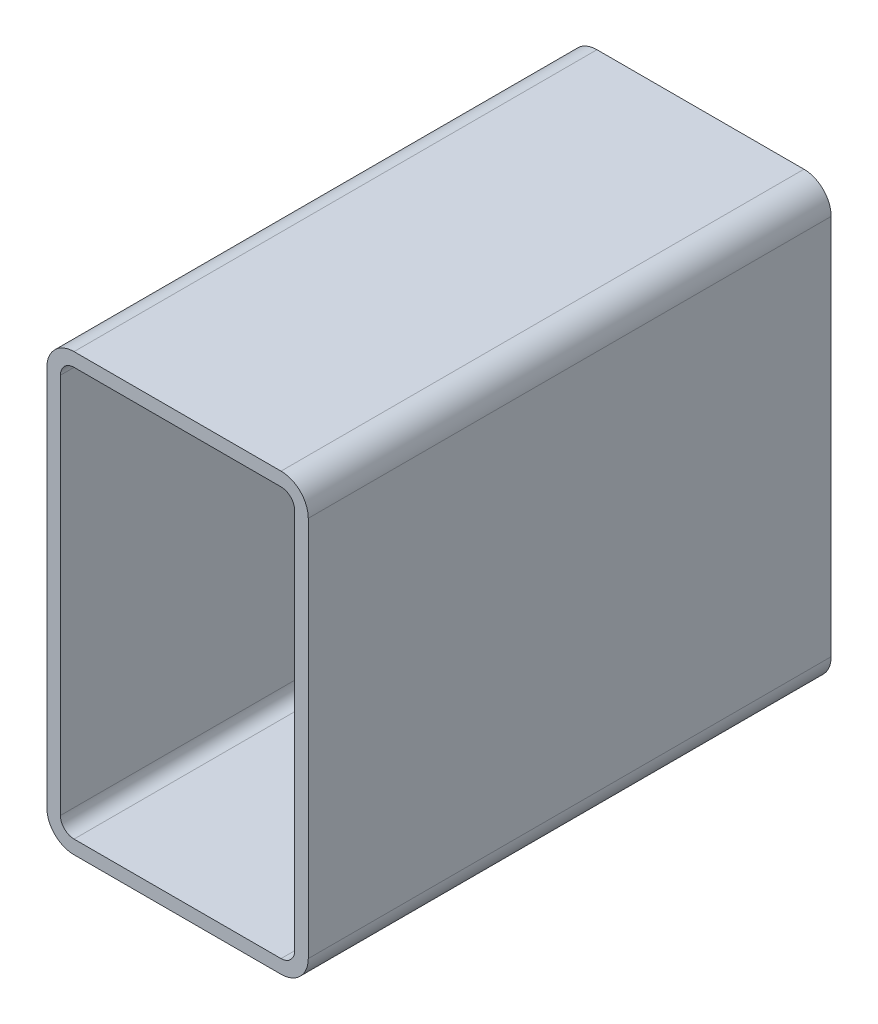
SolidWorks part; units mm, degrees
ref_plane "Front Plane" through (0, 0, 0) normal (0, 0, 1) x (1, 0, 0)
ref_plane "Top Plane" through (0, 0, 0) normal (0, 1, 0) x (1, 0, 0)
ref_plane "Right Plane" through (0, 0, 0) normal (1, 0, 0) x (0, 0, -1)
sketch "Sketch1" plane through (0, 0, 0) normal (0, 0, 1) x (1, 0, 0)
sketch_block_instance "HSS10x6x0.3125-1"
sketch_block "HSS10x6x0.3125"
extrude "Boss-Extrude1" add sketch "Sketch1" along normal blind 304.8
